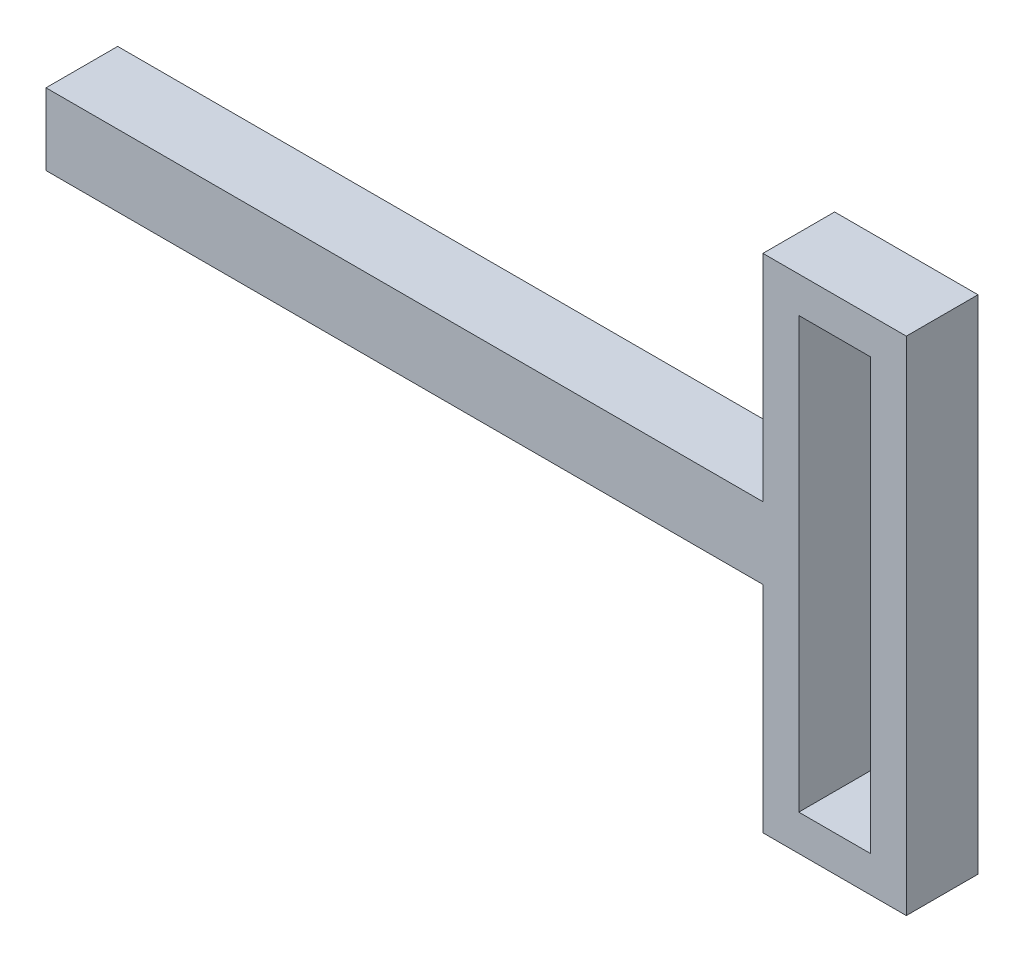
SolidWorks part; units mm, degrees
ref_plane "Front Plane" through (0, 0, 0) normal (0, 0, 1) x (1, 0, 0)
ref_plane "Top Plane" through (0, 0, 0) normal (0, 1, 0) x (1, 0, 0)
ref_plane "Right Plane" through (0, 0, 0) normal (1, 0, 0) x (0, 0, -1)
sketch "Sketch1" plane through (0, 0, 0) normal (0, 0, 1) x (1, 0, 0)
  line L0 (0, 0) -> (0, 10)
  line L1 (0, 10) -> (100, 10)
  line L2 (100, 10) -> (100, 40)
  line L3 (100, 40) -> (120, 40)
  line L4 (120, 40) -> (120, -30)
  line L5 (120, -30) -> (100, -30)
  line L6 (100, -30) -> (100, 0)
  line L7 (100, 0) -> (0, 0)
  dimension "D1" = 10
  dimension "D2" = 30
  dimension "D3" = 30
  dimension "D4" = 20
  dimension "D5" = 100
extrude "Boss-Extrude1" add sketch "Sketch1" along normal blind 10
sketch "Sketch2" plane through (0, 0, 10) normal (0, 0, 1) x (1, 0, 0)
  line L0 (120, 40) -> (100, 40) construction
  line L1 (105, 35) -> (115, 35)
  line L2 (105, 35) -> (105, -25)
  line L3 (105, -25) -> (115, -25)
  line L4 (115, 35) -> (115, -25)
  line L5 (100, 40) -> (100, 10) construction
  dimension "D1" = 10
  dimension "D2" = 60
  dimension "D3" = 5
  dimension "D4" = 5
extrude "Cut-Extrude1" cut sketch "Sketch2" against normal through all
